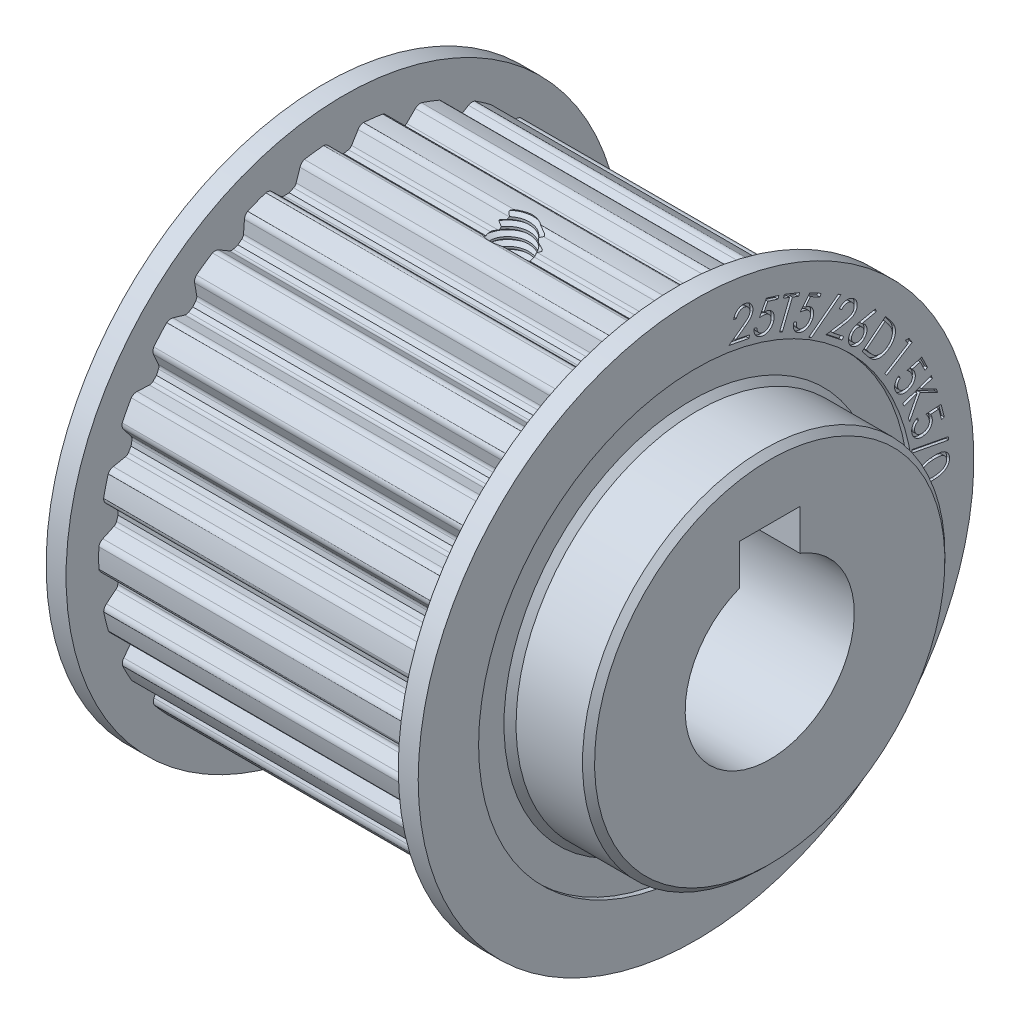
SolidWorks part; units mm, degrees
ref_plane "Front Plane" through (0, 0, 0) normal (0, 0, 1) x (1, 0, 0)
ref_plane "Top Plane" through (0, 0, 0) normal (0, 1, 0) x (1, 0, 0)
ref_plane "Right Plane" through (0, 0, 0) normal (1, 0, 0) x (0, 0, -1)
imported_body "Imported1"
sketch "Sketch1" plane through (30, 0, 0) normal (1, 0, 0) x (0, 0, -1)
  circle A0 centre (0, 0) radius 15
  dimension "D1" = 30
extrude "Boss-Extrude1" add sketch "Sketch1" along normal blind 6.5
chamfer "Chamfer1" distance 0.5 angle 45 2 edges at (30, 0, -15) (36.5, 0, -15)
sketch "Sketch5" plane through (0, 0, 0) normal (-1, 0, 0) x (0, 0, 1)
  circle A0 centre (0, 0) radius 17.5
  dimension "D1" = 35
extrude "Boss-Extrude4" add sketch "Sketch5" along normal blind 1
chamfer "Chamfer2" distance 1 angle 45 1 edges at (-1, 0, 17.5)
move or copy body "Body-Move/Copy1" bodies to move or copy 106 copy no rotation origin (0, 0, 0) rotation axis (1, 0, 0) rotation angle 7
sketch "Sketch8" plane through (36.5, 0, 0) normal (1, 0, 0) x (0, 0, -1)
  line L2 (-2.5, 6.5383) -> (-2.5, 9.9)
  line L3 (-2.5, 9.9) -> (2.5, 9.9)
  line L4 (2.5, 6.5383) -> (2.5, 9.9)
  line L5 (0, 7) -> (2.5, 9.9) construction
  line L6 (-2.5, 9.9) -> (0, 7) construction
  arc A0 (-2.5, 6.5383) -> (2.5, 6.5383) centre (0, 0) ccw
  point P3 (0, 7)
  point P8 (0, 9.9)
  dimension "D1" = 14
  dimension "D2" = 5
  dimension "D3" = 2.9
extrude "Cut-Extrude3" cut sketch "Sketch8" against normal through all
sketch "Sketch9" plane through (0, 9.9, 0) normal (0, -1, 0) x (1, 0, 0)
  line L0 (1, -0.0253) -> (29, -0.0253) construction
  point P0 (15, -0.0253)
hole_wizard "M4 Tapped Hole1" positions "Sketch9" profile "Sketch10" tap size "M4" standard "DIN"
sketch "Sketch10" plane through (15, 9.9, -0.0253) normal (1, 0, 0) x (0, 0, -1)
  line L0 (0, 0) -> (0, 8.9406)
  line L1 (0, 8.9406) -> (1.675, 8.9406)
  line L2 (1.65, 8.9156) -> (1.65, 0)
  line L5 (1.65, 0) -> (0, 0)
  line L7 (1.675, 8.9406) -> (1.65, 8.9156)
  line L8 (-1.675, 8.9406) -> (-1.65, 8.9156) construction
  line L11 (0, -6.35) -> (0, 107.95) construction
  dimension "Thru Tap Drill Dia." = 3.3
  dimension "Thru Tap Drill Depth" = 8.9406
  dimension "Far C'Sink Dia." = 3.35
  dimension "Far C'Sink Angle" = 90
sketch "Sketch11" plane through (29, 0, 0) normal (-1, 0, 0) x (0, 0, 1)
  circle A1 centre (0, 0) radius 21
  circle A2 centre (0, 0) radius 21
  dimension "D1" = 0
extrude "Boss-Extrude5" add sketch "Sketch11" along normal blind 0.25 contours A2
sketch "Sketch12" plane through (1, 0, 0) normal (1, 0, 0) x (0, 0, -1)
  circle A1 centre (0, 0) radius 21
  circle A2 centre (0, 0) radius 21
  dimension "D1" = 0
extrude "Boss-Extrude6" add sketch "Sketch12" along normal blind 0.25
ref_plane "Plane1" through (1.25, 0, 0) normal (1, 0, 0) x (0, 0, -1)
sketch "Sketch13" plane through (1.25, 0, 0) normal (1, 0, 0) x (0, 0, -1)
  circle A0 centre (0, 0) radius 18
  circle A2 centre (0, 0) radius 23
  dimension "D1" = 5
extrude "Boss-Extrude7" add sketch "Sketch13" against normal blind 1.65
ref_plane "Plane2" through (28.75, 0, 0) normal (-1, 0, 0) x (0, 0, 1)
sketch "Sketch14" plane through (28.75, 0, 0) normal (-1, 0, 0) x (0, 0, 1)
  circle A0 centre (0, 0) radius 18
  circle A1 centre (0, 0) radius 23
  dimension "D1" = 5
extrude "Boss-Extrude8" add sketch "Sketch14" against normal blind 1.65
sketch "Sketch15" plane through (1, 0, 0) normal (-1, 0, 0) x (0, 0, 1)
  line L3 (2.5, 9.9) -> (-2.5, 9.9)
  line L4 (-2.5, 9.9) -> (-2.5, 6.5383)
  line L5 (2.5, 6.5383) -> (2.5, 9.9)
  line L6 (2.5, 9.9) -> (-2.5, 9.9)
  line L7 (-2.5, 9.9) -> (-2.5, 6.5383)
  line L8 (2.5, 6.5383) -> (2.5, 9.9)
  arc A1 (-2.5, 6.5383) -> (2.5, 6.5383) centre (0, 0) ccw
  arc A2 (-2.5, 6.5383) -> (2.5, 6.5383) centre (0, 0) ccw
  dimension "D1" = 0
extrude "Cut-Extrude4" cut sketch "Sketch15" against normal through all
sketch "Sketch16" plane through (30.4, 0, 0) normal (1, 0, 0) x (0, 0, -1)
  circle A0 centre (0, 0) radius 18.4853 construction
  text T0 "25T5/26D15K5/0" font "Century Gothic" height 2.5
extrude "Cut-Extrude5" cut sketch "Sketch16" against normal blind 0.25
thread "Thread1" pitch 0.7 start angle 0, offset 0, length 12, pitch 0.7, diameter 3.3
ref_plane "Plane3" through (16.65, 9.9, -0.0253) normal (0, 0, 1) x (1, 0, 0)
sketch "Thread Profile1" plane through (16.65, 9.9, -0.0253) normal (0, 0, 1) x (1, 0, 0)
  line L0 (0, 0) -> (0, 0.7) construction
  line L1 (0, 0) -> (0.3789, 0.2187)
  line L2 (0.3789, 0.2187) -> (0.3789, 0.3062)
  line L3 (0.3789, 0.3062) -> (0, 0.525)
  line L4 (0.3789, 0.2625) -> (0, 0.2625) construction
  line L11 (0, 0) -> (0, 0.525)
  point P2 (0, 0)
  dimension "Pitch" = 0.7
  dimension "Profile_Angle" = 60
  dimension "Profile_Land" = 0.0875
  dimension "Profile_Height" = 0.3789
